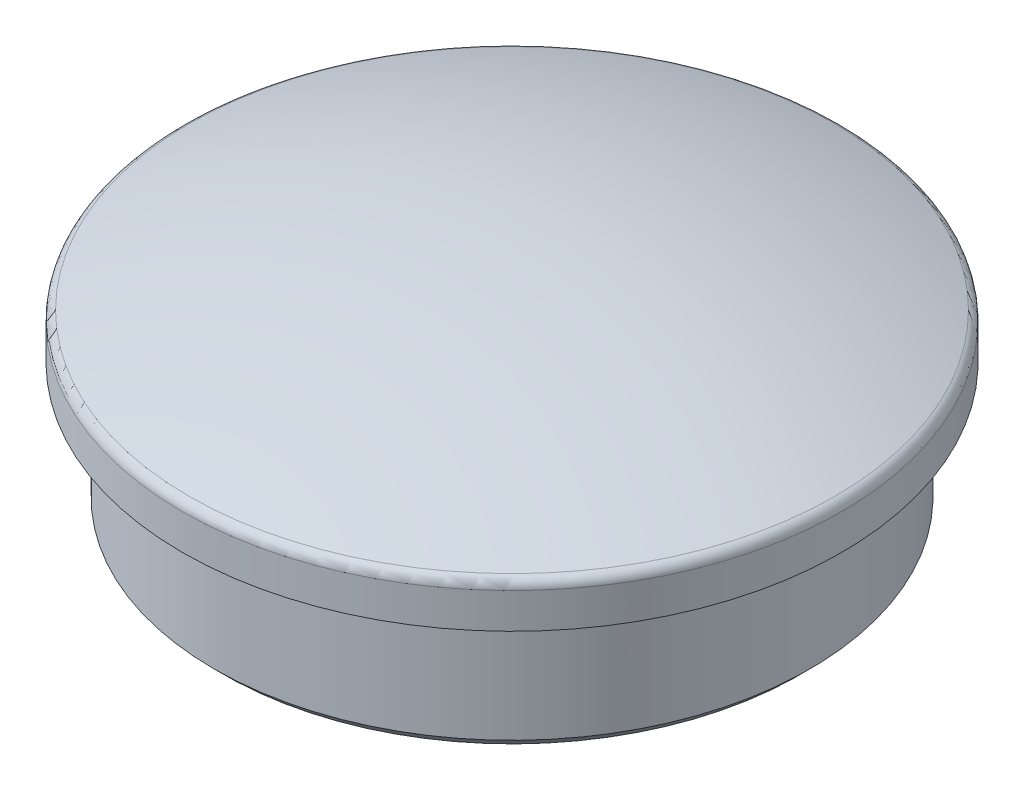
SolidWorks part; units mm, degrees
ref_plane "Plan de face" through (0, 0, 0) normal (0, 0, 1) x (1, 0, 0)
ref_plane "Plan de dessus" through (0, 0, 0) normal (0, 1, 0) x (1, 0, 0)
ref_plane "Plan de droite" through (0, 0, 0) normal (1, 0, 0) x (0, 0, -1)
sketch "Esquisse1" plane through (0, 0, 0) normal (0, 0, 1) x (1, 0, 0)
  line L0 (0, 20.6674) -> (0, -19.3971) construction
  line L1 (0, 0) -> (-14, 0)
  line L2 (-14, 0) -> (-14, 6)
  line L3 (-14, 6) -> (-15.5, 6)
  line L4 (-15.5, 6) -> (-15.5, 8)
  line L5 (0, 11) -> (0, 0)
  line L6 (0, 11) -> (10.2156, 11) construction
  arc A0 (-15.5, 8) -> (0, 11) centre (0, -30.5417) cw
  dimension "D1" = 28
  dimension "D2" = 31
  dimension "D3" = 6
  dimension "D4" = 2
  dimension "D5" = 11
revolve "Révolution1" add sketch "Esquisse1" angle 360 about L0
sketch "Esquisse2" plane through (0, 0, 0) normal (0, -1, 0) x (1, 0, 0)
  line L1 (10.3923, 0) -> (5.1962, 9)
  line L2 (5.1962, 9) -> (-5.1962, 9)
  line L3 (-5.1962, 9) -> (-10.3923, 0)
  line L4 (-10.3923, 0) -> (-5.1962, -9)
  line L5 (-5.1962, -9) -> (5.1962, -9)
  line L6 (5.1962, -9) -> (10.3923, 0)
  circle A0 centre (0, 0) radius 9 construction
  dimension "D1" = 18
extrude "Enlèv. mat.-Extru.1" cut sketch "Esquisse2" against normal blind 9
chamfer "Chanfrein1" distance 0.5 angle 45 1 edges at (0, 0, 14)
fillet "Congé1" radius 0.5 1 edges at (0, 8, 15.5)
